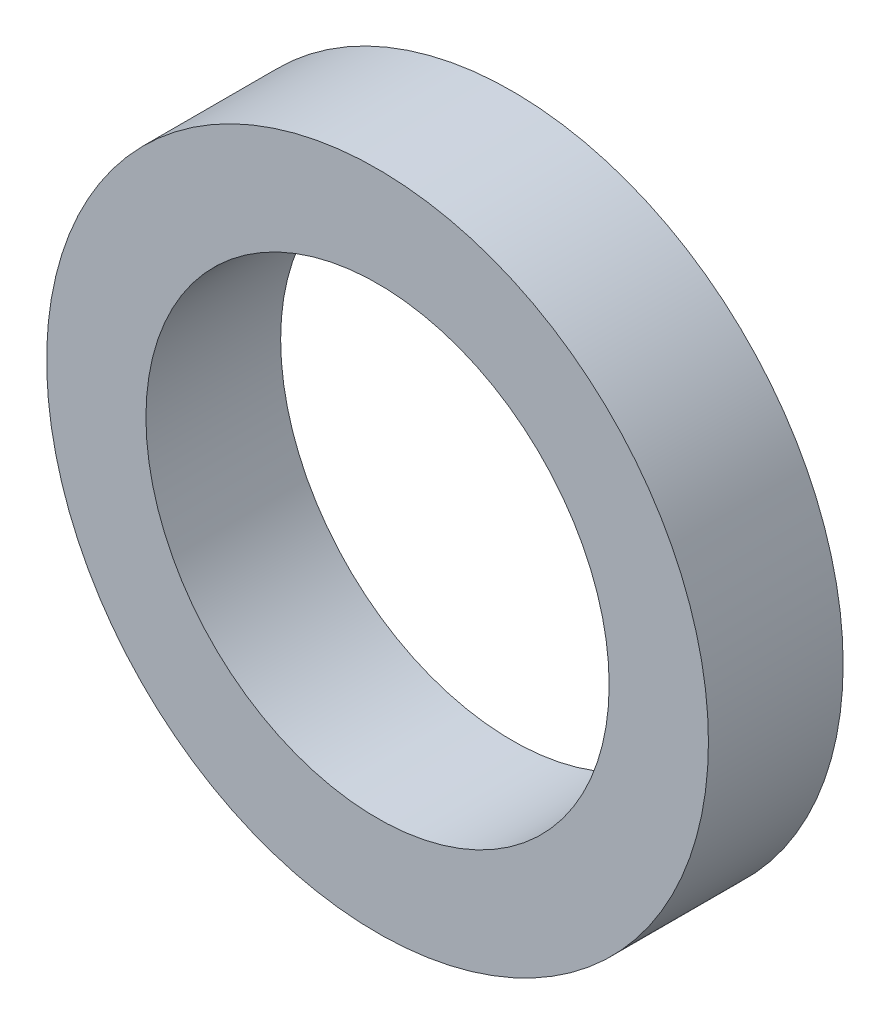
SolidWorks part; units mm, degrees
ref_plane "Plan de face" through (0, 0, 0) normal (0, 0, 1) x (1, 0, 0)
ref_plane "Plan de dessus" through (0, 0, 0) normal (0, 1, 0) x (1, 0, 0)
ref_plane "Plan de droite" through (0, 0, 0) normal (1, 0, 0) x (0, 0, -1)
sketch "Esquisse1" plane through (0, 0, 0) normal (0, 0, 1) x (1, 0, 0)
  circle A0 centre (0, 0) radius 4.9
  circle A1 centre (0, 0) radius 7
  dimension "D1" = 9.8
  dimension "D2" = 14
extrude "Extrusion1" add sketch "Esquisse1" along normal blind 2.85
